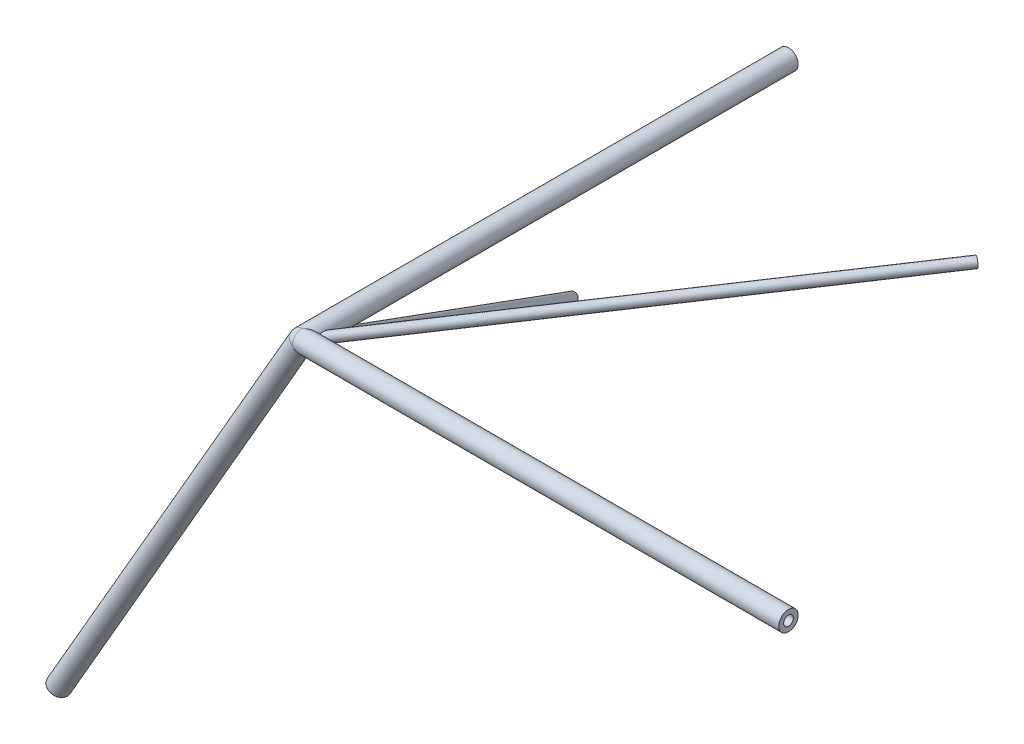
SolidWorks part; units mm, degrees
ref_plane "Front Plane" through (0, 0, 0) normal (0, 0, 1) x (1, 0, 0)
ref_plane "Top Plane" through (0, 0, 0) normal (0, 1, 0) x (1, 0, 0)
ref_plane "Right Plane" through (0, 0, 0) normal (1, 0, 0) x (0, 0, -1)
sketch "Sketch1" plane through (0, 0, 0) normal (0, 0, 1) x (1, 0, 0)
  line L0 (0, 0) -> (500, 0)
  dimension "D1" = 500
sketch "Sketch2" plane through (0, 0, 0) normal (0, 0, 1) x (1, 0, 0)
  line L0 (0, 0) -> (-250, -433.0127)
  line L1 (0, 0) -> (500, 0) construction
  dimension "D1" = 500
  dimension "D2" = 120
sketch "Sketch3" plane through (0, 0, 0) normal (0, 1, 0) x (1, 0, 0)
  line L0 (0, 0) -> (0, 500)
  dimension "D1" = 500
ref_plane "Plane1" through (0, 0, -500) normal (0, 0, 1) x (1, 0, 0)
ref_plane "Plane2" through (0, 0, 0) normal (-0.866, 0.5, 0) x (0, 0, 1)
sketch "Sketch4" plane through (0, 0, 0) normal (-0.866, 0.5, 0) x (0, 0, 1)
  line L0 (0, -50) -> (-50, -50) construction
  line L1 (0, 0) -> (0, -500) construction
ref_plane "Plane3" through (-250, -433.0127, 0) normal (-0.5, -0.866, 0) x (-0.866, 0.5, 0)
ref_plane "Plane4" through (500, 0, 0) normal (1, 0, 0) x (0, 0, -1)
sketch "Sketch5" plane through (-250, -433.0127, 0) normal (-0.5, -0.866, 0) x (-0.866, 0.5, 0)
  circle A0 centre (0, 0) radius 10
  dimension "D1" = 20
sketch "Sketch6" plane through (0, 0, -500) normal (0, 0, 1) x (1, 0, 0)
  circle A0 centre (0, 0) radius 10
  dimension "D1" = 20
sketch "Sketch7" plane through (500, 0, 0) normal (1, 0, 0) x (0, 0, -1)
  circle A0 centre (0, 0) radius 10
  dimension "D1" = 20
sweep "Sweep1" add profiles "Sketch7" path "Sketch1"
sweep "Sweep2" add profiles "Sketch6" path "Sketch3"
sweep "Sweep3" add profiles "Sketch5" path "Sketch2"
surface "Surface-Sweep2"
surface "Surface-Knit7"
surface "Surface-Knit8"
sketch "Sketch11" plane through (0, 0, 0) normal (0, 1, 0) x (1, 0, 0)
  line L0 (0, 0) -> (277.3496, 416.0255)
  line L1 (0, 0) -> (27.8755, 0) construction
  line L2 (0, 0) -> (0, 16.9573) construction
  dimension "D1" = 500
  dimension "D2" = 56.31
sketch "Sketch12" plane through (0, 0, 0) normal (-0.866, 0.5, 0) x (0, 0, 1)
  line L0 (0, 0) -> (-416.0255, -277.3496)
  line L1 (0, 0) -> (55.1963, 0) construction
  line L2 (0, 0) -> (0, 20.9465) construction
  dimension "D1" = 33.69
  dimension "D2" = 500
ref_plane "Plane5" through (277.3496, 0, -416.0255) normal (0.5547, 0, -0.8321) x (-0.8321, 0, -0.5547)
ref_plane "Plane6" through (-138.6748, -240.1918, -416.0255) normal (-0.2773, -0.4804, -0.8321) x (-0.959, 0.1906, 0.2097)
sketch "Sketch13" plane through (277.3496, 0, -416.0255) normal (0.5547, 0, -0.8321) x (-0.8321, 0, -0.5547)
  circle A0 centre (0, 0) radius 5
  dimension "D1" = 10
sketch "Sketch14" plane through (-138.6748, -240.1918, -416.0255) normal (-0.2773, -0.4804, -0.8321) x (-0.959, 0.1906, 0.2097)
  circle A0 centre (0, 0) radius 5
  dimension "D1" = 10
sweep "Sweep4" add profiles "Sketch13" path "Sketch11"
sweep "Sweep5" add profiles "Sketch14" path "Sketch12"
shell "Shell1" thickness 5
